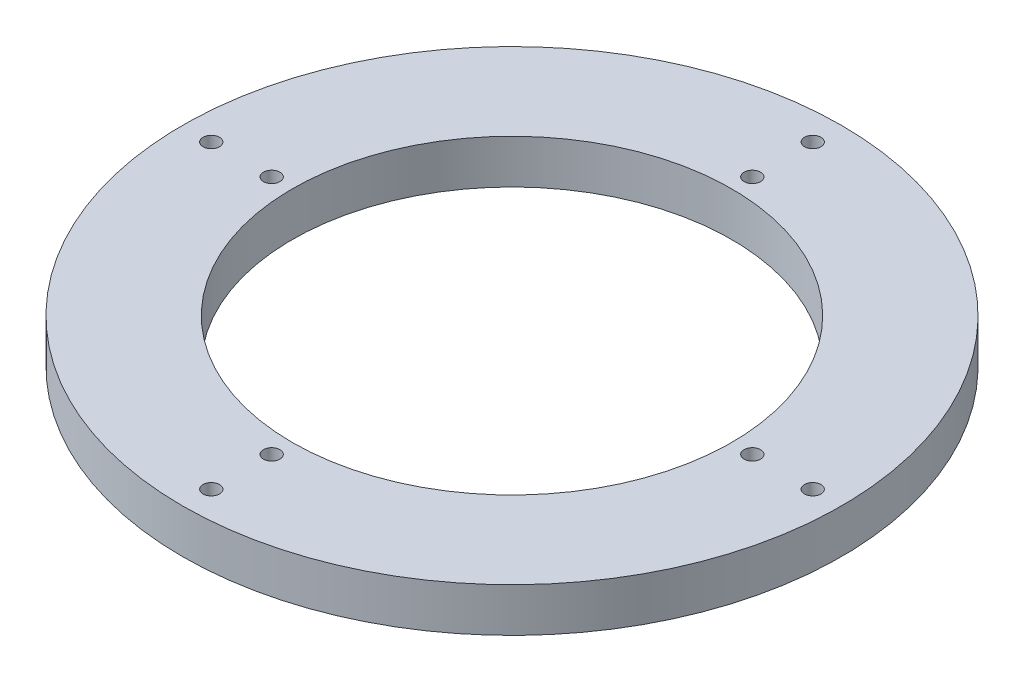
SolidWorks part; units mm, degrees
ref_plane "前视基准面" through (0, 0, 0) normal (0, 0, 1) x (1, 0, 0)
ref_plane "上视基准面" through (0, 0, 0) normal (0, 1, 0) x (1, 0, 0)
ref_plane "右视基准面" through (0, 0, 0) normal (1, 0, 0) x (0, 0, -1)
sketch "草图1" plane through (0, 0, 0) normal (0, 1, 0) x (1, 0, 0)
  line L0 (-40, 0) -> (40, 0) construction
  line L1 (0, 40) -> (0, -40) construction
  circle A0 centre (0, 0) radius 40
  circle A1 centre (0, 0) radius 60
  circle A2 centre (0, 0) radius 53.25 construction
  circle A3 centre (54.75, 0) radius 1.5
  circle A4 centre (0, -54.75) radius 1.5
  circle A5 centre (-54.75, 0) radius 1.5
  circle A6 centre (0, 54.75) radius 1.5
  circle A7 centre (0, 0) radius 42.25 construction
  circle A8 centre (43.75, 0) radius 1.5
  circle A9 centre (0, -43.75) radius 1.5
  circle A10 centre (-43.75, 0) radius 1.5
  circle A11 centre (0, 43.75) radius 1.5
  point P20 (0, 0)
  point P30 (0, 0)
  dimension "D1" = 80
  dimension "D2" = 120
  dimension "D3" = 106.5
  dimension "D4" = 3
  dimension "D6" = 84.5
  dimension "D7" = 3
  dimension "D5" = 4
  dimension "D8" = 4
extrude "凸台-拉伸1" add sketch "草图1" along normal blind 8 contours A1 A0
